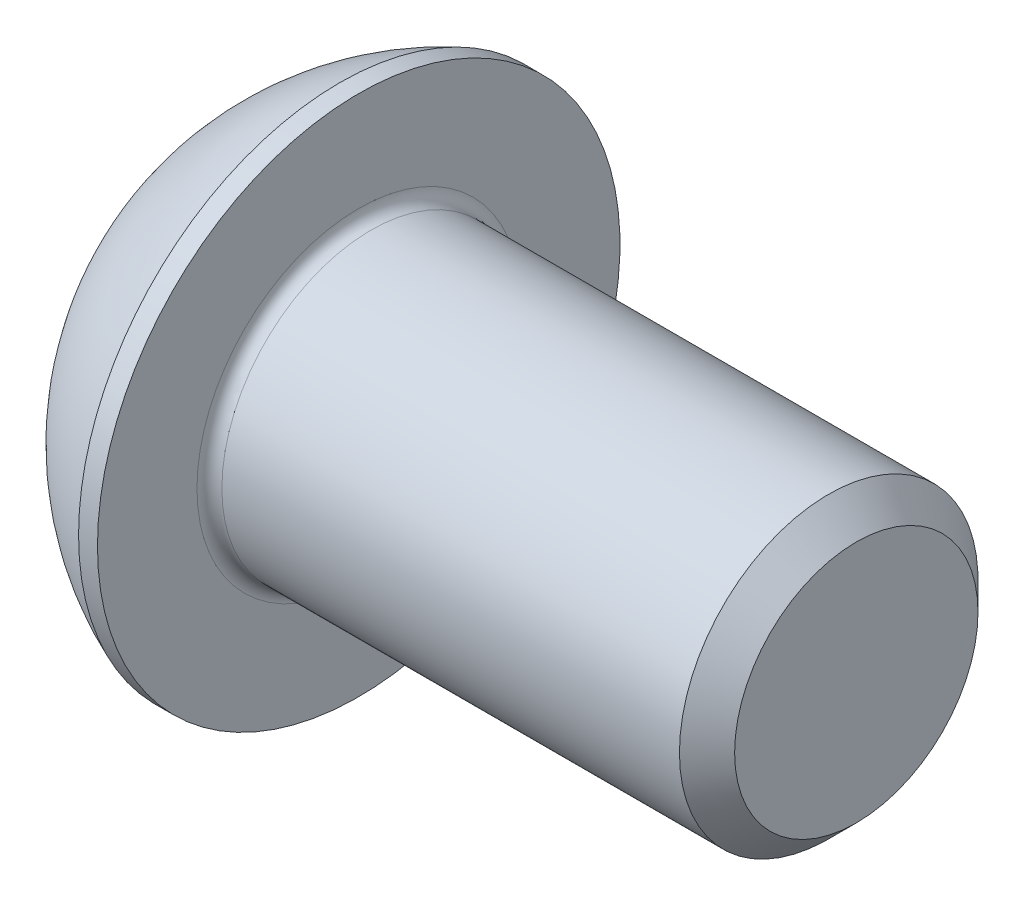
SolidWorks part; units mm, degrees
ref_plane "Plane1" through (0, 0, 0) normal (0, 0, 1) x (1, 0, 0)
ref_plane "Plane2" through (0, 0, 0) normal (0, 1, 0) x (1, 0, 0)
ref_plane "Plane3" through (0, 0, 0) normal (1, 0, 0) x (0, 0, -1)
sketch "BodySke" plane through (0, 0, 0) normal (0, 0, 1) x (1, 0, 0)
  line L0 (13.3, 0) -> (13.3, 2.4455)
  line L1 (12.7455, 3) -> (3.3, 3)
  line L2 (3.3, 3) -> (3.3, 5.25)
  line L3 (3.3, 5.25) -> (2.92, 5.25)
  line L4 (0, 0) -> (101.6, 0) construction
  line L5 (3.3, -5.25) -> (2.92, -5.25) construction
  line L6 (55.6768, -3) -> (3.3, -3) construction
  line L7 (13.3, 0) -> (0, 0)
  line L8 (0, 2.625) -> (0, -2.625) construction
  line L9 (0, 0) -> (0, 2.625)
  line L10 (13.3, 2.4455) -> (12.7455, 3)
  line L11 (13.3, -2.4455) -> (12.7455, -3) construction
  line L12 (4.3, 9.525) -> (4.3, -3) construction
  line L13 (3.3, 9.525) -> (3.3, -3) construction
  arc A1 (0, 2.625) -> (2.92, 5.25) centre (4.9997, 0) cw
revolve "BaseBody" add sketch "BodySke" angle 360 about L4
fillet "Fillet1" radius 0.25 1 edges at (3.3, 0, 3)
sketch "Sketch2" plane through (0, 0, 0) normal (0, 0, 1) x (1, 0, 0)
  line L0 (0, 2) -> (2.08, 2)
  line L1 (2.08, 2) -> (3.2347, 0)
  line L3 (3.2347, 0) -> (0, 0)
  line L4 (0, 0) -> (0, 2)
  line L5 (0, -2) -> (2.08, -2) construction
  line L6 (0, 0) -> (47.625, 0) construction
  dimension "D2" = 60
  dimension "PreBroach_depth" = 2.08
  dimension "PreBroach_dia" = 4
revolve "PreBroach" cut sketch "Sketch2" angle 360 about L6
sketch "Sketch3" plane through (0, 0, 0) normal (1, 0, 0) x (0, 0, -1)
  line L0 (-2, -1.1547) -> (-2, 1.1547)
  line L1 (-2, 1.1547) -> (0, 2.3094)
  line L2 (0, 2.3094) -> (2, 1.1547)
  line L3 (2, 1.1547) -> (2, -1.1547)
  line L4 (2, -1.1547) -> (0, -2.3094)
  line L5 (0, -2.3094) -> (-2, -1.1547)
extrude "Hex" cut sketch "Sketch3" along normal blind 2.08
sketch "ThdSchSke" plane through (0, 0, 0) normal (0, 0, 1) x (1, 0, 0)
  line L0 (5.3, -2.4455) -> (4.9117, -3)
  line L1 (5.3, -2.4455) -> (5.6883, -3)
  line L2 (5.6883, -3) -> (5.6883, -3.75)
  line L3 (-3.175, 0) -> (5.1513, 0) construction
  line L5 (5.6883, -3.75) -> (4.9117, -3.75)
  line L6 (4.9117, -3.75) -> (4.9117, -3)
revolve "ThreadSchematic" [suppressed] cut sketch "ThdSchSke" angle 360 about L3
pattern_linear "ThdSchPat" [suppressed]
equation "\"D1@BodySke\" = \"Head_dia@BodySke\" * .5"
equation "\"Thread_minor@ThreadCosmetic\" = \"Minor_dia@BodySke\""
equation "\"D1@Sketch3\" = \"Hex_size@Sketch3\" / 2"
equation "\"D2@Sketch3\" = \"D1@Sketch3\""
equation "\"D3@Sketch3\" = \"Hex_size@Sketch3\""
equation "\"Thread_length@ThreadCosmetic\" = ((sgn( (\"Length@BodySke\" - \"Advance@BodySke\" * 2.0) - \"Thread_nom@BodySke\" )-1)*( (\"Length@BodySke\" - \"Advance@BodySke\" * 2.0) - \"Thread_nom@BodySke\" ))/-2+ \"Thread_no"
equation "\"Thread_minor@ThdSchSke\" = \"Minor_dia@BodySke\""
equation "\"Diameter@ThdSchSke\" = \"Diameter@BodySke\""
equation "\"Overcut@ThdSchSke\" = \"Diameter@BodySke\" * 1.25"
equation "\"Start@ThdSchSke\" = \"Head_ht@BodySke\" + \"Length@BodySke\" - \"Thread_length@ThreadCosmetic\"  '---Non-countersunk---"
equation "\"Num_threads@ThdSchPat\" = int( \"Thread_length@ThreadCosmetic\" / \"Advance@BodySke\" + 0.999 )  + 1"
equation "\"Advance@ThdSchPat\" = \"Thread_length@ThreadCosmetic\" /  (\"Num_threads@ThdSchPat\" - 1) 'relax it"
equation "\"Num_threads@ThdSchPat\" = \"Num_threads@ThdSchPat\" - sgn( \"Num_threads@ThdSchPat\" - 1) '---chamfered tips only---"
